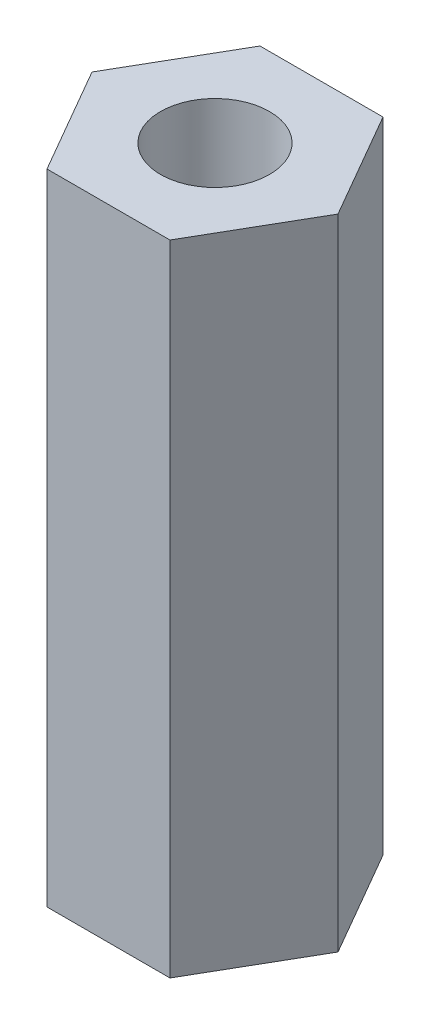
SolidWorks part; units mm, degrees
ref_plane "Front Plane" through (0, 0, 0) normal (0, 0, 1) x (1, 0, 0)
ref_plane "Top Plane" through (0, 0, 0) normal (0, 1, 0) x (1, 0, 0)
ref_plane "Right Plane" through (0, 0, 0) normal (1, 0, 0) x (0, 0, -1)
sketch "Sketch1" plane through (0, 0, 0) normal (0, 1, 0) x (1, 0, 0)
  line L1 (1.8331, 3.175) -> (-1.8331, 3.175)
  line L2 (-1.8331, 3.175) -> (-3.6662, 0)
  line L3 (-3.6662, 0) -> (-1.8331, -3.175)
  line L4 (-1.8331, -3.175) -> (1.8331, -3.175)
  line L5 (1.8331, -3.175) -> (3.6662, 0)
  line L6 (3.6662, 0) -> (1.8331, 3.175)
  circle A0 centre (0, 0) radius 3.175 construction
  circle A1 centre (0, 0) radius 1.6256
  dimension "D2" = 3.2512
  dimension "D1" = 6.35
extrude "Boss-Extrude1" add sketch "Sketch1" along normal blind 19.05
